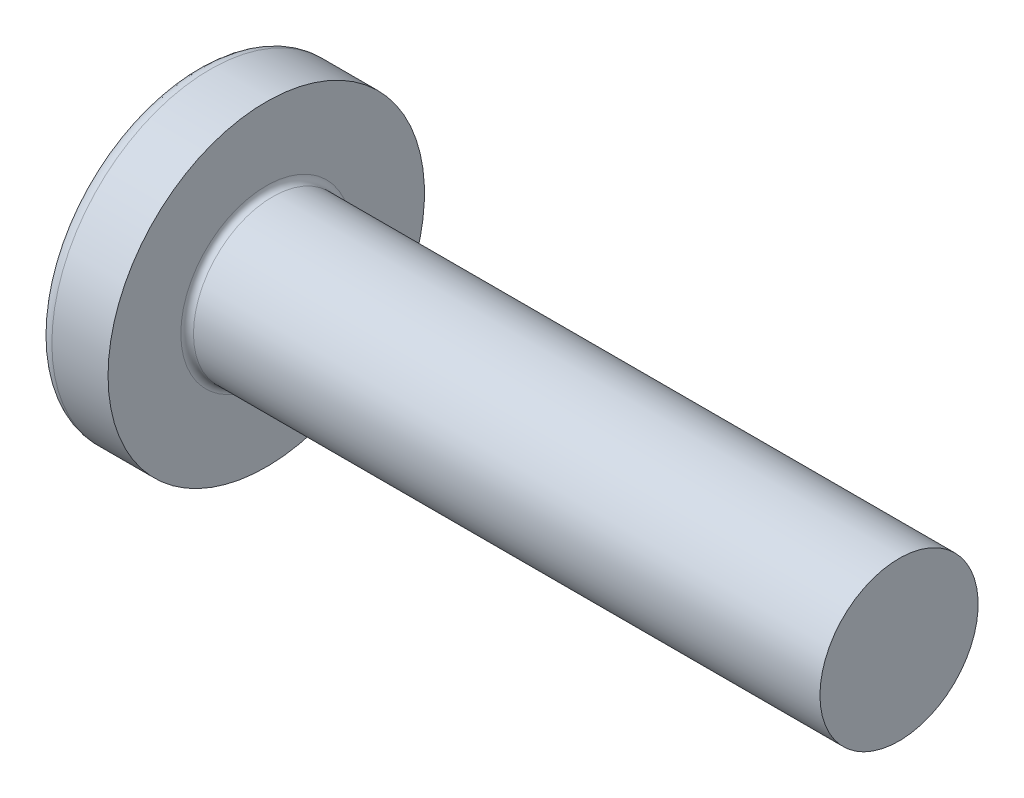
SolidWorks part; units mm, degrees
ref_plane "Front Plane" through (0, 0, 0) normal (0, 0, 1) x (1, 0, 0)
ref_plane "Top Plane" through (0, 0, 0) normal (0, 1, 0) x (1, 0, 0)
ref_plane "Right Plane" through (0, 0, 0) normal (1, 0, 0) x (0, 0, -1)
sketch "BodySke" plane through (0, 0, 0) normal (0, 0, 1) x (1, 0, 0)
  line L0 (0, 0) -> (156.4409, 0) construction
  line L1 (0, 0) -> (0, 48.4317) construction
  line L2 (0, 0) -> (47.5, 0)
  line L3 (47.5, 0) -> (47.5, 5)
  line L4 (47.5, 5) -> (7.5, 5)
  line L5 (7.5, 5) -> (7.5, 10)
  line L6 (7.5, 10) -> (3.9501, 10)
  line L7 (9, 0) -> (9, 8.4138) construction
  line L8 (7.5, 0) -> (7.5, 8.4138) construction
  arc A0 (0, 0) -> (3.2319, 9.6424) centre (16, 0) cw
  arc A1 (3.9501, 10) -> (3.2319, 9.6424) centre (3.9501, 9.1) ccw
  point P14 (47.5, 4.172)
  dimension "Head_crown_radius" = 16
  dimension "Head_fillet_radius" = 0.9
  dimension "Length" = 40
  dimension "Diameter" = 10
  dimension "Head_height" = 7.5
  dimension "Head_diameter" = 20
  dimension "Advance" = 1.5
  dimension "Thread_length" = 40
  dimension "Thread_minor" = 8.344
revolve "BaseBody" add sketch "BodySke" angle 360 about L0
fillet "Fillet1" radius 0.4 1 edges at (7.5, 0, 5)
ref_plane "Plane1" through (5.69, 0, 0) normal (1, 0, 0) x (0, 0, -1)
sketch "RecessTopSke" plane through (0, 0, 0) normal (1, 0, 0) x (0, 0, -1)
  line L0 (-1.08, 4.95) -> (1.08, -4.95) construction
  line L1 (-1.08, 4.95) -> (1.08, 4.95)
  line L2 (-1.08, 4.95) -> (-1.08, -4.95)
  line L3 (-1.08, -4.95) -> (1.08, -4.95)
  line L4 (1.08, 4.95) -> (1.08, -4.95)
  dimension "Cross_diameter" = 9.9
  dimension "Cross_width" = 2.16
sketch "RecessBottomSke" plane through (5.69, 0, 0) normal (1, 0, 0) x (0, 0, -1)
  line L0 (-1.08, 4.95) -> (-1.08, -4.95) construction
  line L1 (-1.08, -2.1285) -> (1.08, -2.1285)
  line L2 (-1.08, -2.1285) -> (-1.08, 2.1285)
  line L3 (-1.08, 2.1285) -> (1.08, 2.1285)
  line L4 (1.08, -2.1285) -> (1.08, 2.1285)
  line L5 (1.08, 4.95) -> (1.08, -4.95) construction
  line L6 (-1.08, -2.1285) -> (1.08, 2.1285) construction
  dimension "D1" = 4.257
loft "Recess" cut profiles "RecessTopSke", "RecessBottomSke"
pattern_circular "RecPat" count 2 over 90 about axis through (0, 0, 0) along (1, 0, 0) of "Recess"
sketch "RecessCoreSke" plane through (0, 0, 0) normal (0, 0, 1) x (1, 0, 0)
  line L0 (0, 0) -> (51.8769, 0) construction
  line L1 (0, 0) -> (6.3173, 0)
  line L2 (6.3173, 0) -> (5.69, 1.9305)
  line L3 (5.69, 1.9305) -> (0, 2.3284)
  line L4 (0, 2.3284) -> (0, 0)
  dimension "D1" = 5.69
  dimension "Bottom_Angle" = 18
  dimension "Draft_Angle" = 4
  dimension "Diameter" = 3.861
revolve "RecessCore" cut sketch "RecessCoreSke" angle 360 about L0
sketch "ThdSchSke" plane through (0, 0, 0) normal (0, 0, 1) x (1, 0, 0)
  line L0 (0, 0) -> (54.2585, 0) construction
  line L1 (47.022, 5.9561) -> (47.022, 5)
  line L2 (47.022, 5.9561) -> (47.978, 5.9561)
  line L3 (47.978, 5.9561) -> (47.978, 5)
  line L4 (47.978, 5) -> (47.5, 4.172)
  line L5 (47.5, 4.172) -> (47.022, 5)
  line L6 (47.5, 5) -> (7.5, 5) construction
revolve "ThreadSchematic" [suppressed] cut sketch "ThdSchSke" angle 360 about L0
pattern_linear "ThdSchPat" [suppressed]
equation "\"Thread_minor@ThreadCosmetic\" = \"Thread_minor@BodySke\""
equation "\"Thread_length@ThreadCosmetic\" = \"Thread_length@BodySke\""
equation "\"D1@RecessBottomSke\" = \"Cross_diameter@RecessTopSke\"  * 0.43"
equation "\"D1@RecessCoreSke\" = \"Cross_depth@Plane1\""
equation "\"Tooth_Num@ThdSchPat\" =  int( \"Thread_length@BodySke\" / \"Advance@BodySke\" ) "
equation "\"Advance@ThdSchPat\" = \"Advance@BodySke\""
